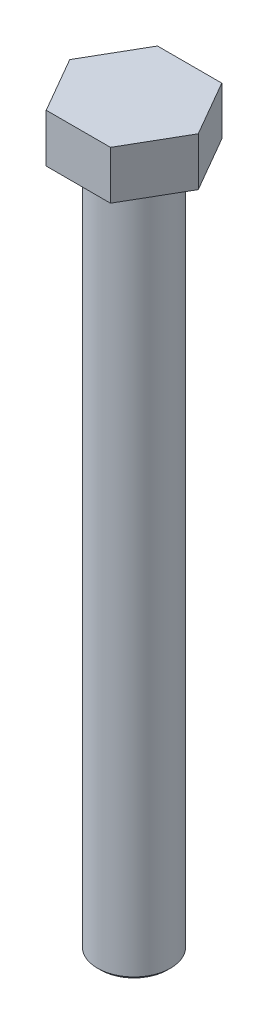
SolidWorks part; units mm, degrees
ref_plane "Front Plane" through (0, 0, 0) normal (0, 0, 1) x (1, 0, 0)
ref_plane "Top Plane" through (0, 0, 0) normal (0, 1, 0) x (1, 0, 0)
ref_plane "Right Plane" through (0, 0, 0) normal (1, 0, 0) x (0, 0, -1)
sketch "Sketch1" plane through (0, 0, 0) normal (0, 1, 0) x (1, 0, 0)
  line L0 (0, 0) -> (9.6703, 0) construction
  line L1 (8.2636, 0) -> (4.1318, 7.1565)
  line L2 (4.1318, 7.1565) -> (-4.1318, 7.1565)
  line L3 (-4.1318, 7.1565) -> (-8.2636, 0)
  line L4 (-8.2636, 0) -> (-4.1318, -7.1564)
  line L5 (-4.1318, -7.1564) -> (4.1318, -7.1564)
  line L6 (4.1318, -7.1564) -> (8.2636, 0)
  circle A0 centre (0, 0) radius 7.1564 construction
  dimension "D1" = 14.3129
extrude "Extrude1" add sketch "Sketch1" against normal blind 6.223
sketch "Sketch2" plane through (0, -6.223, 0) normal (0, -1, 0) x (1, 0, 0)
  circle A0 centre (0, 0) radius 4.699
  dimension "D1" = 9.398
extrude "Extrude2" add sketch "Sketch2" along normal blind 88.9
chamfer "Chamfer1" distance 0.3962 angle 45 1 edges at (0, -95.123, -4.699)
